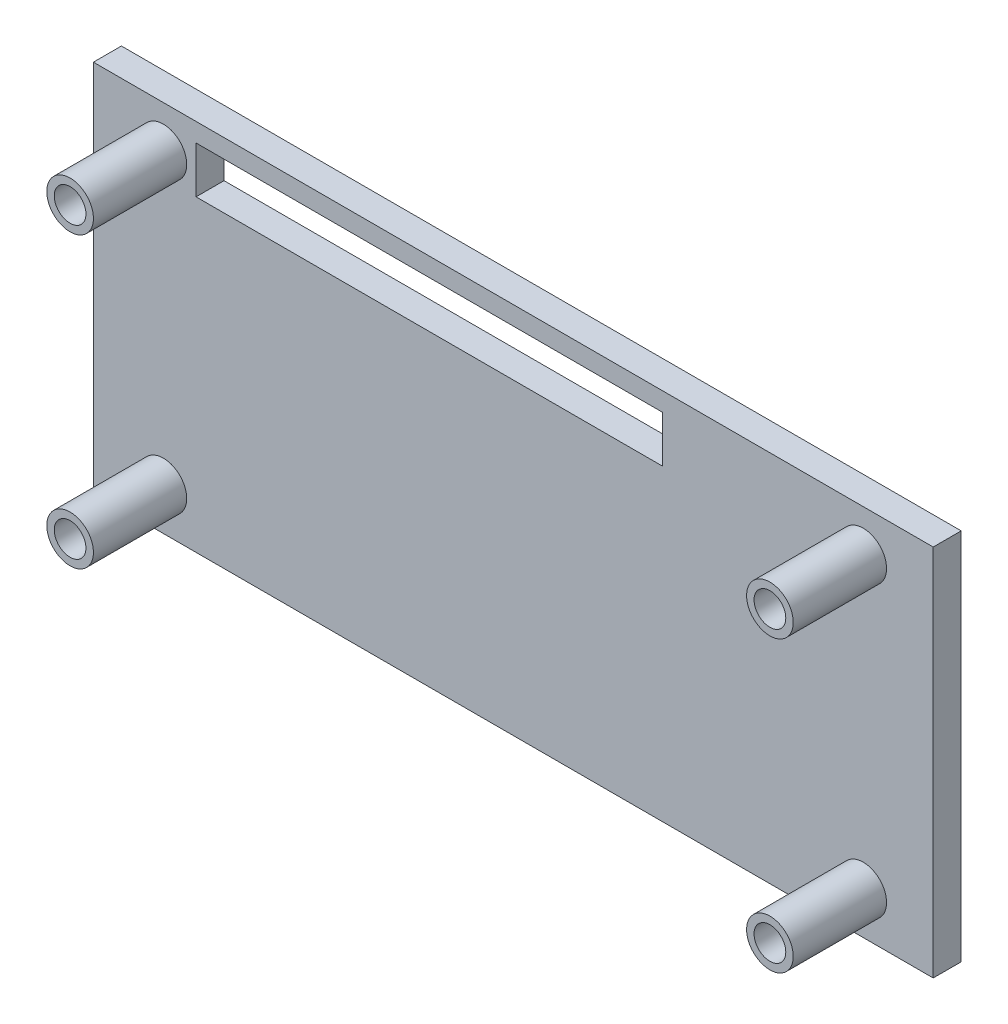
SolidWorks part; units mm, degrees
ref_plane "Piano frontale" through (0, 0, 0) normal (0, 0, 1) x (1, 0, 0)
ref_plane "Piano superiore" through (0, 0, 0) normal (0, 1, 0) x (1, 0, 0)
ref_plane "Piano destro" through (0, 0, 0) normal (1, 0, 0) x (0, 0, -1)
sketch "Schizzo1" plane through (0, 0, 0) normal (0, 0, 1) x (1, 0, 0)
  line L1 (-45, 20) -> (45, 20)
  line L2 (-45, 20) -> (-45, -20)
  line L3 (-45, -20) -> (45, -20)
  line L4 (45, 20) -> (45, -20)
  line L5 (-45, 20) -> (45, -20) construction
  line L6 (-45, -20) -> (45, 20) construction
  point P0 (0, 0)
  dimension "D1" = 90
  dimension "D2" = 40
extrude "Estrusione-Estrusione1" add sketch "Schizzo1" along normal blind 3
sketch "Schizzo2" plane through (0, 0, 3) normal (0, 0, 1) x (1, 0, 0)
  line L1 (-37.5, 15.5) -> (37.5, 15.5)
  line L2 (-37.5, 15.5) -> (-37.5, -15.5)
  line L3 (-37.5, -15.5) -> (37.5, -15.5)
  line L4 (37.5, 15.5) -> (37.5, -15.5)
  line L5 (-37.5, 15.5) -> (37.5, -15.5) construction
  line L6 (-37.5, -15.5) -> (37.5, 15.5) construction
  point P0 (0, 0)
  dimension "D1" = 75
  dimension "D2" = 31
sketch "Schizzo3" plane through (0, 0, 3) normal (0, 0, 1) x (1, 0, 0)
  circle A0 centre (-37.5, 15.5) radius 2.5
  circle A1 centre (-37.5, -15.5) radius 2.5
  circle A2 centre (37.5, -15.5) radius 2.5
  circle A3 centre (37.5, 15.5) radius 2.5
  dimension "D1" = 5
  dimension "D2" = 5
  dimension "D3" = 2
extrude "Estrusione-Estrusione2" add sketch "Schizzo3" along normal blind 10
hole_wizard "Foro per Vite M3-1" positions "Schizzo4" profile "Schizzo5" hole size "M3" standard "ISO"
sketch "Schizzo4" plane through (0, 0, 13) normal (0, 0, 1) x (1, 0, 0)
  point P0 (-37.5, 15.5)
  point P3 (-37.5, -15.5)
  point P6 (37.5, 15.5)
  point P9 (37.5, -15.5)
sketch "Schizzo5" plane through (-37.5, 15.5, 13) normal (1, 0, 0) x (0, -1, 0)
  line L0 (0, 0) -> (0, 13)
  line L1 (0, 13) -> (1.7, 13)
  line L2 (1.7, 13) -> (1.7, 0)
  line L5 (1.7, 0) -> (0, 0)
  line L11 (0, -6.35) -> (0, 107.95) construction
  dimension "Thru Hole Dia." = 3.4
  dimension "Thru Hole Depth" = 13
sketch "Schizzo6" plane through (0, 0, 3) normal (0, 0, 1) x (1, 0, 0)
  line L0 (-37.5, 15.5) -> (37.5, 15.5) construction
  line L1 (-34, 18) -> (16, 18)
  line L2 (-34, 18) -> (-34, 13)
  line L3 (-34, 13) -> (16, 13)
  line L4 (16, 18) -> (16, 13)
  line L5 (-34, 18) -> (16, 13) construction
  line L6 (-34, 13) -> (16, 18) construction
  line L7 (-45, 20) -> (-45, -20) construction
  point P0 (-9, 15.5)
  point P7 (-8.8097, 15.5)
  dimension "D1" = 50
  dimension "D2" = 5
  dimension "D3" = 11
extrude "Taglio-Estrusione1" cut sketch "Schizzo6" against normal through all
